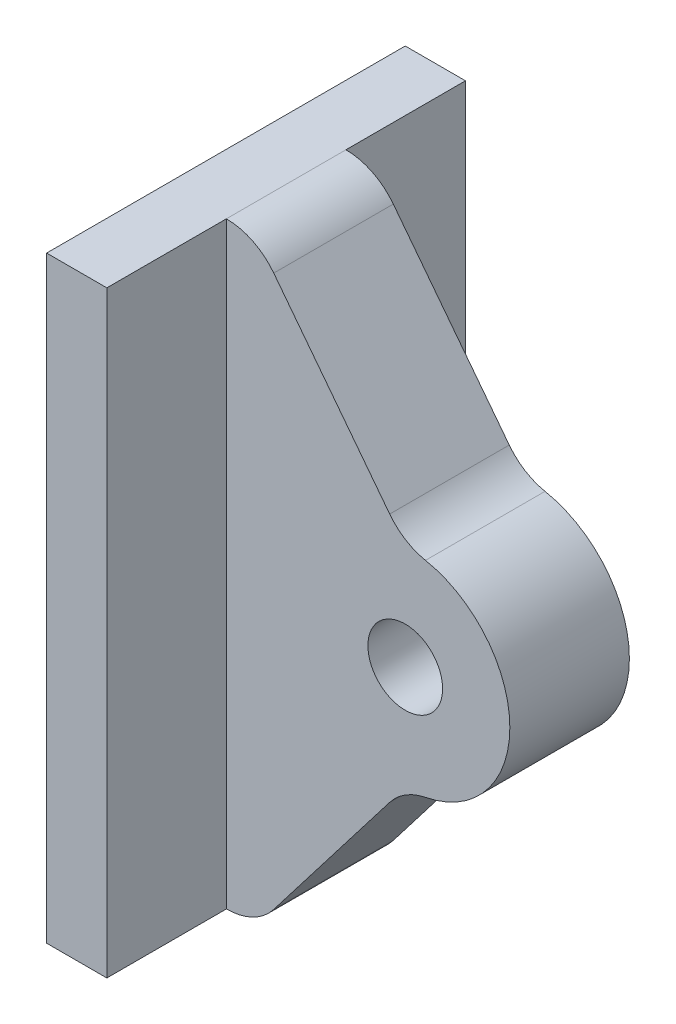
SolidWorks part; units mm, degrees
ref_plane "Front Plane" through (0, 0, 0) normal (0, 0, 1) x (1, 0, 0)
ref_plane "Top Plane" through (0, 0, 0) normal (0, 1, 0) x (1, 0, 0)
ref_plane "Right Plane" through (0, 0, 0) normal (1, 0, 0) x (0, 0, -1)
sketch "Sketch1" plane through (0, 0, 0) normal (0, 0, 1) x (1, 0, 0)
  line L0 (-26.9851, -140.9067) -> (-37.1451, -140.9067) construction
  line L1 (-34.5858, -128.2067) -> (-37.1451, -128.2067)
  line L2 (-34.5858, -153.6067) -> (-37.1451, -153.6067)
  line L3 (-26.9851, -128.2067) -> (-37.1451, -128.2067) construction
  line L4 (-37.1451, -153.6067) -> (-37.1451, -128.2067)
  line L5 (-27.646, -146.2108) -> (-32.5725, -152.6153)
  line L6 (-27.646, -135.6025) -> (-32.5725, -129.198)
  line L7 (-26.9851, -153.6067) -> (-37.1451, -153.6067) construction
  arc A0 (-26.1245, -145.2676) -> (-26.1245, -136.5458) centre (-26.9851, -140.9067) ccw
  arc A1 (-27.646, -146.2108) -> (-26.1245, -145.2676) centre (-25.6327, -147.7595) cw
  arc A2 (-27.646, -135.6025) -> (-26.1245, -136.5458) centre (-25.6327, -134.0538) ccw
  arc A3 (-34.5858, -128.2067) -> (-32.5725, -129.198) centre (-34.5858, -130.7467) cw
  arc A4 (-34.5858, -153.6067) -> (-32.5725, -152.6153) centre (-34.5858, -151.0667) ccw
  point P13 (-26.9851, -145.3517)
  point P16 (-26.9851, -136.4617)
  point P19 (-33.3351, -128.2067)
  point P22 (-33.3351, -153.6067)
  dimension "D2" = 2.54
  dimension "D1" = 10.16
extrude "Extrude1" add sketch "Sketch1" along normal blind 5.08
sketch "Sketch2" plane through (0, 0, 5.08) normal (0, 0, 1) x (1, 0, 0)
  circle A0 centre (-26.9851, -140.9067) radius 1.5875
extrude "Cut-Extrude1" cut sketch "Sketch2" against normal through all
sketch "Sketch3" plane through (0, 0, 5.08) normal (0, 0, 1) x (1, 0, 0)
  line L0 (-37.1451, -128.2067) -> (-37.1451, -153.6067) construction
  line L1 (-37.1451, -128.2067) -> (-37.1451, -153.6067)
  line L2 (-37.1451, -153.6067) -> (-34.5858, -153.6067) construction
  line L3 (-37.1451, -153.6067) -> (-34.5858, -153.6067)
  line L4 (-34.5858, -128.2067) -> (-37.1451, -128.2067) construction
  line L5 (-34.5858, -128.2067) -> (-37.1451, -128.2067)
  line L6 (-34.5858, -153.6067) -> (-34.5858, -128.2067)
extrude "Extrude2" add sketch "Sketch3" along normal blind 5.08
sketch "Sketch4" plane through (0, 0, 0) normal (0, 0, -1) x (-1, 0, 0)
  line L0 (34.5858, -128.2067) -> (37.1451, -128.2067) construction
  line L1 (37.1451, -128.2067) -> (37.1451, -153.6067) construction
  line L2 (37.1451, -153.6067) -> (34.5858, -153.6067) construction
  line L3 (34.5858, -128.2067) -> (37.1451, -128.2067)
  line L4 (37.1451, -128.2067) -> (37.1451, -153.6067)
  line L5 (37.1451, -153.6067) -> (34.5858, -153.6067)
  line L6 (34.5858, -128.2067) -> (34.5858, -153.6067)
extrude "Extrude3" add sketch "Sketch4" along normal blind 5.08
